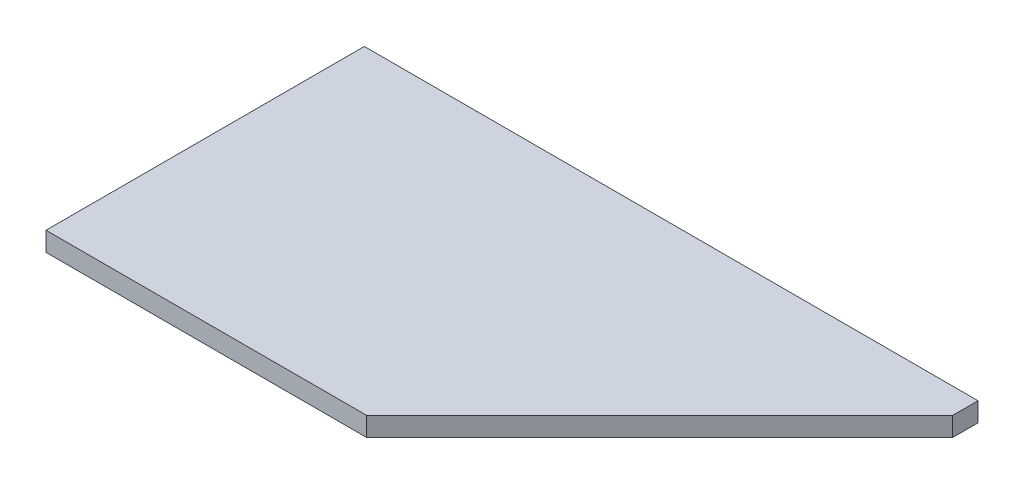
SolidWorks part; units mm, degrees
ref_plane "前视基准面" through (0, 0, 0) normal (0, 0, 1) x (1, 0, 0)
ref_plane "上视基准面" through (0, 0, 0) normal (0, 1, 0) x (1, 0, 0)
ref_plane "右视基准面" through (0, 0, 0) normal (1, 0, 0) x (0, 0, -1)
sketch "草图1" plane through (0, 0, 0) normal (0, 1, 0) x (1, 0, 0)
  line L1 (-8, 4.15) -> (8, 4.15)
  line L2 (-8, 4.15) -> (-8, -4.15)
  line L3 (-8, -4.15) -> (8, -4.15)
  line L4 (8, 4.15) -> (8, -4.15)
  line L5 (-8, 4.15) -> (8, -4.15) construction
  line L6 (-8, -4.15) -> (8, 4.15) construction
  point P0 (0, 0)
  dimension "D1" = 8.3
  dimension "D2" = 16
extrude "凸台-拉伸1" add sketch "草图1" along normal blind 0.5
sketch "草图2" plane through (0, 0.5, 0) normal (0, 1, 0) x (1, 0, 0)
  line L0 (8, -4.15) -> (0.3629, -4.15)
  line L1 (-8, -4.15) -> (8, -4.15) construction
  line L2 (0.3629, -4.15) -> (8, 3.4871)
  line L3 (8, -4.15) -> (8, 4.15) construction
  line L4 (8, 3.4871) -> (8, -4.15)
  line L5 (0.6464, -4.0786) -> (8.2885, 3.5635) construction
  dimension "D1" = 0.15
extrude "切除-拉伸1" cut sketch "草图2" against normal blind 0.5
